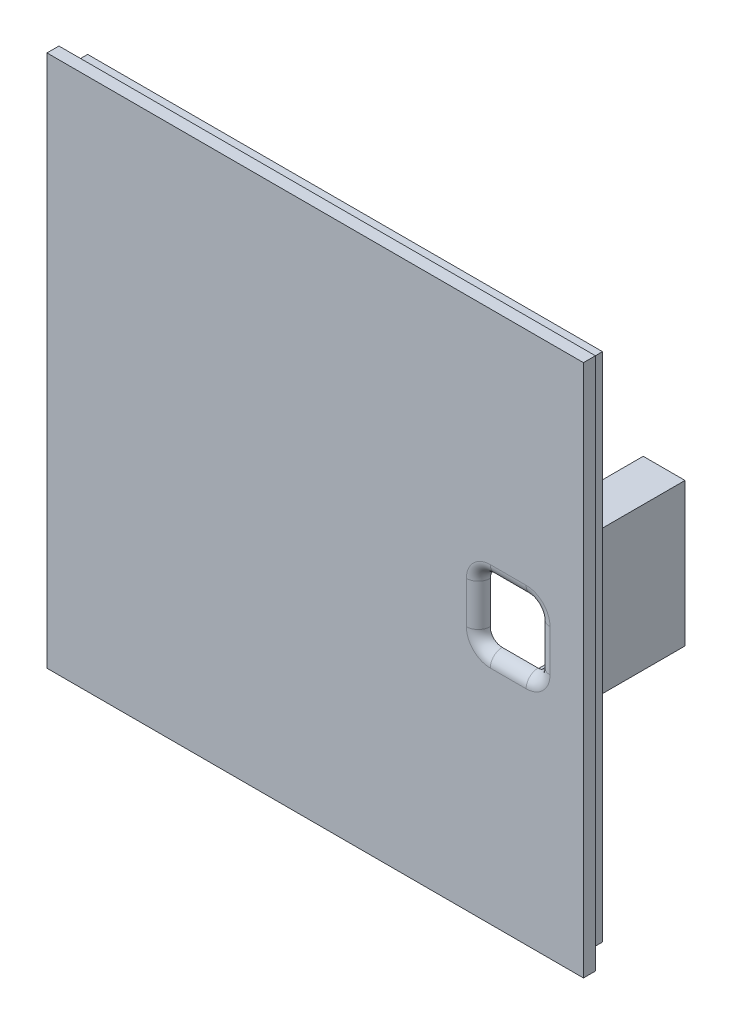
SolidWorks part; units mm, degrees
ref_plane "Front Plane" through (0, 0, 0) normal (0, 0, 1) x (1, 0, 0)
ref_plane "Top Plane" through (0, 0, 0) normal (0, 1, 0) x (1, 0, 0)
ref_plane "Right Plane" through (0, 0, 0) normal (1, 0, 0) x (0, 0, -1)
sketch "Sketch1" plane through (0, 0, 0) normal (0, 0, 1) x (1, 0, 0)
  line L0 (-51.6774, -49.1183) -> (38.1226, -49.1183)
  line L1 (38.1226, -49.1183) -> (38.1226, 40.0817)
  line L2 (38.1226, 40.0817) -> (-51.6774, 40.0817)
  line L3 (-51.6774, 40.0817) -> (-51.6774, -49.1183)
  line L4 (-49.6774, -47.1183) -> (36.1226, -47.1183)
  line L5 (36.1226, -47.1183) -> (36.1226, 38.0817)
  line L6 (36.1226, 38.0817) -> (-49.6774, 38.0817)
  line L7 (-49.6774, 38.0817) -> (-49.6774, -47.1183)
extrude "Boss-Extrude1" add sketch "Sketch1" along normal blind 2
sketch "Sketch2" plane through (0, 0, 2) normal (0, 0, 1) x (1, 0, 0)
  line L0 (-47.6774, 36.0817) -> (-47.6774, -45.1183)
  line L1 (-49.6774, 38.0817) -> (36.1226, 38.0817)
  line L2 (-49.6774, 38.0817) -> (-49.6774, -47.1183)
  line L3 (-49.6774, -47.1183) -> (36.1226, -47.1183)
  line L4 (36.1226, 38.0817) -> (36.1226, -47.1183)
  line L5 (-47.6774, -45.1183) -> (34.1226, -45.1183)
  line L6 (34.1226, 36.0817) -> (34.1226, -45.1183)
  line L7 (-47.6774, 36.0817) -> (34.1226, 36.0817)
  dimension "D1" = 2
extrude "Boss-Extrude2" add sketch "Sketch2" against normal blind 5
sketch "Sketch3" plane through (0, 0, 2) normal (0, 0, 1) x (1, 0, 0)
  line L1 (-47.6774, 36.0817) -> (34.1226, 36.0817)
  line L2 (-47.6774, 36.0817) -> (-47.6774, -45.1183)
  line L3 (-47.6774, -45.1183) -> (34.1226, -45.1183)
  line L4 (34.1226, 36.0817) -> (34.1226, -45.1183)
extrude "Boss-Extrude3" add sketch "Sketch3" against normal blind 2
sketch "Sketch4" plane through (0, 0, -3) normal (0, 0, -1) x (-1, 0, 0)
  line L15 (-36.3126, -47.3083) -> (49.8674, -47.3083)
  line L16 (49.8674, -47.3083) -> (49.8674, 38.2717)
  line L17 (49.8674, 38.2717) -> (-36.3126, 38.2717)
  line L18 (-36.3126, 38.2717) -> (-36.3126, -47.3083)
  line L19 (-36.3126, -47.3083) -> (49.8674, -47.3083)
  line L20 (49.8674, -47.3083) -> (49.8674, 38.2717)
  line L21 (49.8674, 38.2717) -> (-36.3126, 38.2717)
  line L22 (-36.3126, 38.2717) -> (-36.3126, -47.3083)
  line L33 (-36.1226, -47.1183) -> (49.6774, -47.1183)
  line L34 (49.6774, -47.1183) -> (49.6774, 38.0817)
  line L35 (49.6774, 38.0817) -> (-36.1226, 38.0817)
  line L36 (-36.1226, 38.0817) -> (-36.1226, -47.1183)
  line L37 (-36.1226, -47.1183) -> (49.6774, -47.1183)
  line L38 (49.6774, -47.1183) -> (49.6774, 38.0817)
  line L39 (49.6774, 38.0817) -> (-36.1226, 38.0817)
  line L40 (-36.1226, 38.0817) -> (-36.1226, -47.1183)
  dimension "D1" = 0.19
  dimension "D2" = 0
extrude "Boss-Extrude4" add sketch "Sketch4" against normal up to surface (3 mm away)
sketch "Sketch5" plane through (0, 0, 0) normal (0, 0, -1) x (-1, 0, 0)
  line L0 (-31.1226, 7.5091) -> (-31.1226, -16.4909)
  line L1 (-3.2226, -36.1183) -> (16.7774, -36.1183)
  line L2 (-3.2226, -36.1183) -> (-3.2226, -31.1183)
  line L4 (16.7774, -36.1183) -> (16.7774, -31.1183)
  line L5 (-3.2226, -36.1183) -> (16.7774, -31.1183) construction
  line L6 (-3.2226, -31.1183) -> (16.7774, -36.1183) construction
  line L7 (-22.1226, -16.4909) -> (-31.1226, -16.4909)
  line L8 (-22.1226, 7.5091) -> (-22.1226, -16.4909)
  line L9 (-22.1226, 7.5091) -> (-31.1226, 7.5091)
  line L10 (16.7774, -31.1183) -> (16.7774, -29.1183)
  line L11 (-5.2226, -38.1183) -> (18.7774, -38.1183)
  line L12 (18.7774, -38.1183) -> (18.7774, -29.1183)
  line L13 (-5.2226, -29.1183) -> (-3.2226, -29.1183)
  line L14 (47.6774, -45.1183) -> (47.6774, 36.0817)
  line L15 (47.6774, 36.0817) -> (-34.1226, 36.0817)
  line L16 (-34.1226, 36.0817) -> (-34.1226, -45.1183)
  line L17 (-34.1226, -45.1183) -> (47.6774, -45.1183)
  line L18 (47.6774, -45.1183) -> (47.6774, 36.0817)
  line L19 (47.6774, 36.0817) -> (-34.1226, 36.0817)
  line L20 (-34.1226, 36.0817) -> (-34.1226, -45.1183)
  line L21 (-34.1226, -45.1183) -> (47.6774, -45.1183)
  line L22 (-5.2226, -38.1183) -> (-5.2226, -29.1183)
  line L23 (-3.2226, -31.1183) -> (-3.2226, -29.1183)
  line L24 (16.7774, -29.1183) -> (18.7774, -29.1183)
  line L25 (-5.2226, -29.1183) -> (18.7774, -29.1183) construction
  line L26 (-3.2226, -31.1183) -> (16.7774, -31.1183) construction
  line L27 (6.7774, -45.1183) -> (6.7774, -42.0859)
  line L28 (-24.1226, 5.5091) -> (-24.1226, 7.5091)
  line L29 (-24.1226, 5.5091) -> (-29.1226, 5.5091)
  line L30 (-24.1226, 5.5091) -> (-24.1226, -14.4909)
  line L31 (-24.1226, -14.4909) -> (-29.1226, -14.4909)
  line L32 (-29.1226, 5.5091) -> (-29.1226, -14.4909)
  line L33 (-24.1226, 5.5091) -> (-29.1226, -14.4909) construction
  line L34 (-24.1226, -14.4909) -> (-29.1226, 5.5091) construction
  line L35 (-24.1226, 7.5091) -> (-24.1226, -16.4909)
  point P0 (6.7774, -33.6183)
  point P17 (-26.6226, -4.4909)
  dimension "D1" = 20
  dimension "D2" = 5
  dimension "D4" = 7
  dimension "D6" = 0
  dimension "D7" = 5
  dimension "D8" = 20
  dimension "D9" = 5
  dimension "D3" = 0
  dimension "D5" = 2
  dimension "D10" = 2
extrude "Boss-Extrude7" add sketch "Sketch5" along normal blind 20 contours L35 L31 L32 L29 L28 L9 L0 L7
sketch "Sketch9" plane through (0, 0, -20) normal (0, 0, -1) x (-1, 0, 0)
  line L1 (-24.1226, 7.5091) -> (-31.1226, 7.5091)
  line L2 (-24.1226, 7.5091) -> (-24.1226, -16.4909)
  line L3 (-24.1226, -16.4909) -> (-31.1226, -16.4909)
  line L4 (-31.1226, 7.5091) -> (-31.1226, -16.4909)
extrude "Boss-Extrude8" add sketch "Sketch9" along normal blind 2
sketch "Sketch10" plane through (0, 0, 0) normal (0, 0, -1) x (-1, 0, 0)
  line L1 (-28.5226, -9.9909) -> (-22.5226, -9.9909)
  line L2 (-30.5226, -7.9909) -> (-30.5226, -0.9909)
  line L3 (-28.5226, 1.0091) -> (-22.5226, 1.0091)
  line L4 (-20.5226, -7.9909) -> (-20.5226, -0.9909)
  line L5 (-30.5226, -9.9909) -> (-20.5226, 1.0091) construction
  line L6 (-30.5226, 1.0091) -> (-20.5226, -9.9909) construction
  line L7 (-29.1226, 5.5091) -> (-29.1226, -14.4909) construction
  arc A0 (-30.5226, -0.9909) -> (-28.5226, 1.0091) centre (-28.5226, -0.9909) cw
  arc A1 (-30.5226, -7.9909) -> (-28.5226, -9.9909) centre (-28.5226, -7.9909) ccw
  arc A2 (-22.5226, -9.9909) -> (-20.5226, -7.9909) centre (-22.5226, -7.9909) ccw
  arc A3 (-22.5226, 1.0091) -> (-20.5226, -0.9909) centre (-22.5226, -0.9909) cw
  point P0 (-25.5226, -4.4909)
  point P5 (-26.0209, -4.599)
  point P8 (-25.5463, -4.4909)
  dimension "D4" = 2
  dimension "D1" = 10
  dimension "D2" = 11
  dimension "D3" = 3.6
extrude "Cut-Extrude10" cut sketch "Sketch10" against normal blind 2
fillet "Fillet3" radius 2 1 edges at (29.1226, -4.4909, 0)
fillet "Fillet4" radius 2 8 edges at (21.1083, -9.4051, 2) (25.5226, -9.9909, 2) (29.9368, -9.4051, 2) (30.5226, -4.4909, 2) (29.9368, 0.4233, 2) (25.5226, 1.0091, 2) (21.1083, 0.4233, 2) (20.5226, -4.4909, 2)
